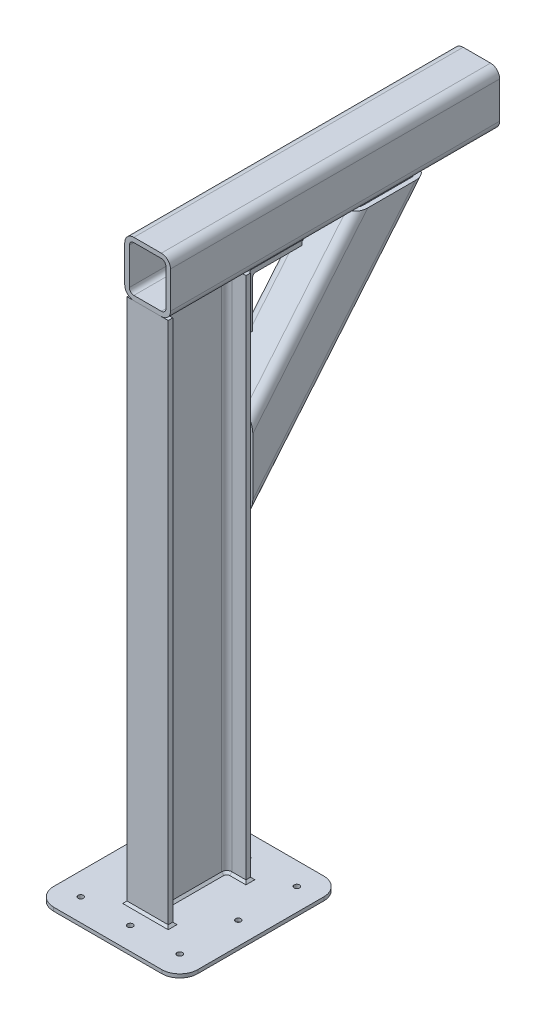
SolidWorks part; units mm, degrees
other "DetailItem1"
other "DetailItem2"
other "DetailItem5"
other "DetailItem6"
other "DetailItem7"
other "DetailItem8"
ref_plane "Front Plane" through (0, 0, 0) normal (0, 0, 1) x (1, 0, 0)
ref_plane "Top Plane" through (0, 0, 0) normal (0, 1, 0) x (1, 0, 0)
ref_plane "Right Plane" through (0, 0, 0) normal (1, 0, 0) x (0, 0, -1)
sketch "Sketch1" plane through (0, 0, 0) normal (0, 0, 1) x (1, 0, 0)
  line L0 (0, 0) -> (0, 1459.336)
  dimension "D1" = 1459.336
other "Structural Member1"
ref_plane "Plane2" through (0, 0, 0) normal (0, 1, 0) x (-1, 0, 0)
sketch "Sketch171" plane through (0, 0, 0) normal (0, 1, 0) x (-1, 0, 0)
  line L0 (-57.15, -114.3) -> (-57.15, -101.6)
  line L1 (-57.15, -101.6) -> (-18.2372, -101.6)
  line L2 (-3.9624, -87.3252) -> (-3.9624, 87.3252)
  line L3 (-18.2372, 101.6) -> (-57.15, 101.6)
  line L4 (-57.15, 101.6) -> (-57.15, 114.3)
  line L5 (-57.15, 114.3) -> (57.15, 114.3)
  line L6 (57.15, 114.3) -> (57.15, 101.6)
  line L7 (57.15, 101.6) -> (18.2372, 101.6)
  line L8 (3.9624, 87.3252) -> (3.9624, -87.3252)
  line L9 (18.2372, -101.6) -> (57.15, -101.6)
  line L10 (57.15, -101.6) -> (57.15, -114.3)
  line L11 (57.15, -114.3) -> (-57.15, -114.3)
  line L12 (3.9624, 0) -> (-3.9624, 0) construction
  arc A0 (-18.2372, -101.6) -> (-3.9624, -87.3252) centre (-18.2372, -87.3252) ccw
  arc A1 (-3.9624, 87.3252) -> (-18.2372, 101.6) centre (-18.2372, 87.3252) ccw
  arc A2 (18.2372, 101.6) -> (3.9624, 87.3252) centre (18.2372, 87.3252) ccw
  arc A3 (3.9624, -87.3252) -> (18.2372, -101.6) centre (18.2372, -87.3252) ccw
  point P20 (0, 114.3)
  point P23 (0, 0)
  point P25 (0, -114.3)
  dimension "Ri" = 14.2748
  dimension "Tw" = 7.9248
  dimension "Bf" = 114.3
  dimension "Depth" = 228.6
  dimension "Tf" = 12.7
sketch "Sketch14" plane through (0, 0, 0) normal (0, 1, 0) x (1, 0, 0)
  line L1 (-200, 225) -> (200, 225)
  line L2 (-200, 225) -> (-200, -225)
  line L3 (-200, -225) -> (200, -225)
  line L4 (200, 225) -> (200, -225)
  line L5 (-200, 225) -> (200, -225) construction
  line L6 (-200, -225) -> (200, 225) construction
  point P0 (0, 0)
  dimension "D1" = 450
  dimension "D2" = 400
extrude "Extrude1" add sketch "Sketch14" against normal blind 10 separate body
other "Fillet Bead1" parameters "D10"=6, "D11"=6, "D12"=0, "D13"=3, "D14"=0
hole_wizard "Ø15.0 (15) Diameter Hole1" positions "Sketch16" profile "Sketch17" hole size "Ø15.0" standard "Ansi Metric"
sketch "Sketch16" plane through (0, 0, 0) normal (0, 1, 0) x (-1, 0, 0)
  line L1 (137.5, 162.5) -> (-137.5, 162.5)
  line L2 (137.5, 162.5) -> (137.5, -162.5)
  line L3 (137.5, -162.5) -> (-137.5, -162.5)
  line L4 (-137.5, 162.5) -> (-137.5, -162.5)
  line L5 (137.5, 162.5) -> (-137.5, -162.5) construction
  line L6 (137.5, -162.5) -> (-137.5, 162.5) construction
  point P0 (-137.5, 162.5)
  point P104 (137.5, 162.5)
  point P106 (137.5, -162.5)
  point P108 (-137.5, -162.5)
  point P110 (0, 162.5)
  point P112 (0, -162.5)
  point P114 (137.5, 0)
  point P116 (-137.5, 0)
  dimension "D1" = 325
  dimension "D2" = 275
sketch "Sketch17" plane through (137.5, 0, 162.5) normal (1, 0, 0) x (0, 0, 1)
  line L0 (0, 0) -> (0, 10)
  line L1 (0, 10) -> (7.5, 10)
  line L2 (7.5, 10) -> (7.5, 0)
  line L5 (7.5, 0) -> (0, 0)
  line L11 (0, -6.35) -> (0, 107.95) construction
  dimension "Thru Hole Dia." = 15
  dimension "Thru Hole Depth" = 10
fillet "Fillet1" radius 50 4 edges at (-200, -5, -225) (200, -5, -225) (-200, -5, 225) (200, -5, 225)
sketch "Sketch18" plane through (0, 0, 0) normal (1, 0, 0) x (0, 0, -1)
  line L1 (114.3, 1459.336) -> (101.6, 1459.336) construction
  line L2 (114.3, 1459.336) -> (114.3, 1309.336)
  line L3 (114.3, 1309.336) -> (126.8, 1309.336)
  line L4 (126.8, 1436.836) -> (126.8, 1309.336)
  line L5 (136.8, 1446.836) -> (264.3, 1446.836)
  line L6 (114.3, 1459.336) -> (114.3, 0) construction
  line L7 (114.3, 1459.336) -> (264.3, 1459.336)
  line L8 (264.3, 1446.836) -> (264.3, 1459.336)
  arc A0 (126.8, 1436.836) -> (136.8, 1446.836) centre (136.8, 1436.836) cw
  dimension "D2" = 10
  dimension "D1" = 12.5
  dimension "D3" = 150
  dimension "D4" = 150
extrude "Extrude2" add sketch "Sketch18" along normal mid plane 100 separate body
sketch "Sketch172" plane through (0, 0, 0) normal (1, 0, 0) x (0, 0, -1)
  line L0 (0, 1459.336) -> (800, 1459.336)
  line L1 (500, 1459.336) -> (0, 859.336)
  line L2 (0, 0) -> (0, 1459.336) construction
  dimension "D1" = 500
  dimension "D2" = 600
  dimension "D3" = 800
other "Structural Member2"
ref_plane "Plane3" through (0, 1459.336, 0) normal (0, 0, -1) x (0, 1, 0)
sketch "Sketch110" plane through (0, 1459.336, 0) normal (0, 0, -1) x (0, 1, 0)
  line L0 (-38.1, -63.5) -> (38.1, -63.5)
  line L1 (-50.8, -50.8) -> (-50.8, 50.8)
  line L2 (38.1, 63.5) -> (-38.1, 63.5)
  line L3 (50.8, 50.8) -> (50.8, -50.8)
  line L4 (-38.1, -76.2) -> (38.1, -76.2)
  line L5 (-63.5, -50.8) -> (-63.5, 50.8)
  line L6 (38.1, 76.2) -> (-38.1, 76.2)
  line L7 (63.5, 50.8) -> (63.5, -50.8)
  line L8 (0, 76.2) -> (0, 63.5) construction
  line L9 (0, 63.5) -> (0, -63.5) construction
  line L10 (0, -63.5) -> (0, -76.2) construction
  line L11 (-63.5, 0) -> (-50.8, 0) construction
  line L12 (-50.8, 0) -> (50.8, 0) construction
  line L13 (50.8, 0) -> (63.5, 0) construction
  arc A0 (63.5, 50.8) -> (38.1, 76.2) centre (38.1, 50.8) ccw
  arc A1 (38.1, -76.2) -> (63.5, -50.8) centre (38.1, -50.8) ccw
  arc A2 (-63.5, -50.8) -> (-38.1, -76.2) centre (-38.1, -50.8) ccw
  arc A3 (-38.1, 76.2) -> (-63.5, 50.8) centre (-38.1, 50.8) ccw
  arc A4 (-38.1, 63.5) -> (-50.8, 50.8) centre (-38.1, 50.8) ccw
  arc A5 (50.8, 50.8) -> (38.1, 63.5) centre (38.1, 50.8) ccw
  arc A6 (38.1, -63.5) -> (50.8, -50.8) centre (38.1, -50.8) ccw
  arc A7 (-50.8, -50.8) -> (-38.1, -63.5) centre (-38.1, -50.8) ccw
  point P6 (-63.5, 76.2)
  point P33 (63.5, 76.2)
  point P35 (-63.5, -76.2)
  point P36 (63.5, -76.2)
  point P37 (0, 0)
  dimension "D1" = 25.4
  dimension "Thickness" = 12.7
  dimension "V_leg" = 152.4
  dimension "H_leg" = 127
other "Trim/Extend1"
other "Trim/Extend2"
other "Fillet Bead2" parameters "D10"=6, "D11"=6, "D12"=0, "D13"=3, "D14"=0
other "Fillet Bead5" parameters "D10"=6, "D11"=6, "D12"=0, "D13"=3, "D14"=0
other "Fillet Bead6" parameters "D10"=6, "D11"=6, "D12"=0, "D13"=3, "D14"=0
other "Fillet Bead7" parameters "D10"=6, "D11"=6, "D12"=0, "D13"=3, "D14"=0
other "Fillet Bead8" parameters "D10"=6, "D11"=6, "D12"=0, "D13"=3, "D14"=0
